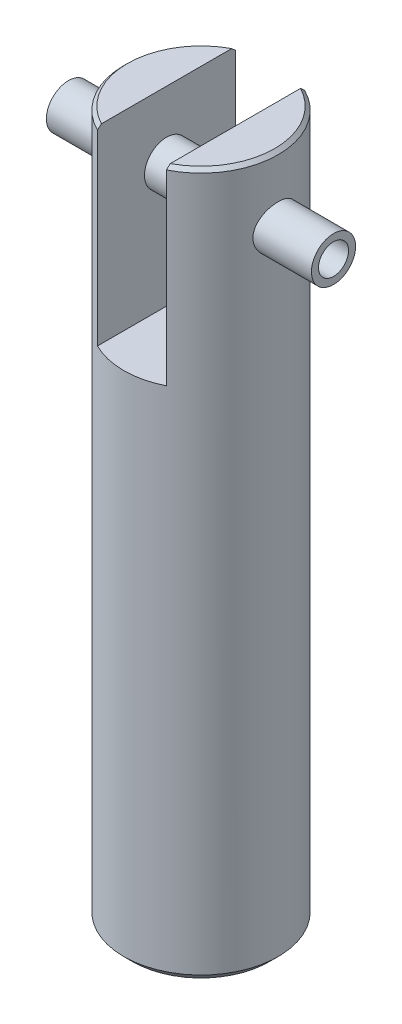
SolidWorks part; units mm, degrees
ref_plane "Front Plane" through (0, 0, 0) normal (0, 0, 1) x (1, 0, 0)
ref_plane "Top Plane" through (0, 0, 0) normal (0, 1, 0) x (1, 0, 0)
ref_plane "Right Plane" through (0, 0, 0) normal (1, 0, 0) x (0, 0, -1)
sketch "Sketch1" plane through (0, 0, 0) normal (0, 1, 0) x (1, 0, 0)
  circle A0 centre (0, 0) radius 5.5499
  dimension "D1" = 11.0998
extrude "Boss-Extrude1" add sketch "Sketch1" along normal blind 50.8
sketch "Sketch2" plane through (0, 50.8, 0) normal (0, 1, 0) x (1, 0, 0)
  line L1 (-2.4765, 9.525) -> (2.4765, 9.525)
  line L2 (-2.4765, 9.525) -> (-2.4765, -9.525)
  line L3 (-2.4765, -9.525) -> (2.4765, -9.525)
  line L4 (2.4765, 9.525) -> (2.4765, -9.525)
  line L5 (-2.4765, 9.525) -> (2.4765, -9.525) construction
  line L6 (-2.4765, -9.525) -> (2.4765, 9.525) construction
  point P0 (0, 0)
  dimension "D1" = 19.05
  dimension "D2" = 4.953
extrude "Cut-Extrude1" cut sketch "Sketch2" against normal blind 13.6906
sketch "Sketch3" plane through (0, 0, 0) normal (1, 0, 0) x (0, 0, -1)
  line L0 (0, 0) -> (0, 85.1842) construction
  line L1 (4.9667, 50.8) -> (-4.9667, 50.8) construction
  circle A0 centre (0, 46.0375) radius 1.5875
  dimension "D1" = 3.175
  dimension "D2" = 4.7625
extrude "Cut-Extrude2" cut sketch "Sketch3" against normal through all and the other way through all
chamfer "Chamfer1" distance 0.635 angle 45 1 edges at (0, 0, 5.5499)
chamfer "Chamfer2" distance 0.254 angle 45 2 edges at (-5.5499, 50.8, 0) (5.5499, 50.8, 0)
sketch "Sketch4" plane through (0, 0, 0) normal (1, 0, 0) x (0, 0, -1)
  circle A0 centre (0, 46.0375) radius 1.5875 construction
  circle A1 centre (0, 46.0375) radius 1.5875
extrude "Boss-Extrude2" add sketch "Sketch4" along normal mid plane 19.05
sketch "Sketch5" plane through (9.525, 0, 0) normal (1, 0, 0) x (0, 0, -1)
  circle A2 centre (0, 46.0375) radius 1.0795
  circle A3 centre (0, 46.0375) radius 1.0795
  dimension "D1" = 0.508
extrude "Cut-Extrude3" cut sketch "Sketch5" against normal through all
